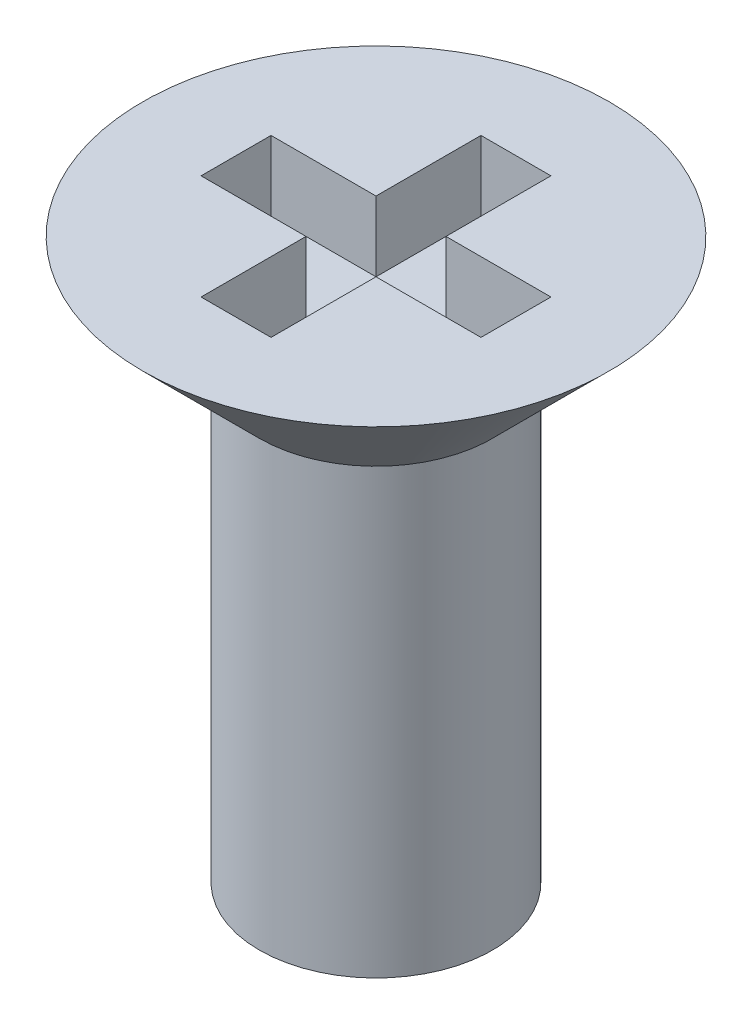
SolidWorks part; units mm, degrees
ref_plane " FRONT" through (0, 0, 0) normal (0, 0, 1) x (1, 0, 0)
ref_plane "TOP" through (0, 0, 0) normal (0, 1, 0) x (1, 0, 0)
ref_plane "SIDE" through (0, 0, 0) normal (1, 0, 0) x (0, 0, -1)
sketch "Sketch1" plane through (0, 0, 0) normal (0, 0, 1) x (1, 0, 0)
  line L0 (0, 90.8693) -> (0, -44.7514) construction
  line L1 (0, 0) -> (2.5, 0)
  line L2 (2.5, 0) -> (2.5, 9.5)
  line L3 (2.5, 9.5) -> (5, 12)
  line L4 (5, 12) -> (0, 12)
  line L5 (0, 0) -> (0, 12)
revolve "FLATHEAD" add sketch "Sketch1" angle 360 about L0
sketch "Sketch2" plane through (0, 12, 0) normal (0, 1, 0) x (-1, 0, 0)
  line L0 (-0.75, 0) -> (0.75, 0)
  line L1 (-0.75, 0) -> (-0.75, 3)
  line L2 (0.75, 3) -> (-0.75, 3)
  line L3 (0.75, 3) -> (0.75, 0)
  line L5 (50, 0) -> (-50, 0) construction
  line L6 (0, 0) -> (0, 3) construction
extrude "PHILLIPS" cut sketch "Sketch2" against normal blind 1.5
pattern_circular "PHILLIPS PATTERN" count 4 every 90 about axis through (0, 0, 0) along (0, 1, 0) of "PHILLIPS"
equation "\"HeadHeight@Sketch1\"=.5*\"ThreadDia@Sketch1\""
equation "\"1/2PhillipsLength@Sketch2\"=.6*\"ThreadDia@Sketch1\""
equation "\"PhillipsWidth@Sketch2\" = .5*\"1/2PhillipsLength@Sketch2\""
equation "\"PhillipsDepth@PHILLIPS\"=\"PhillipsWidth@Sketch2\""
